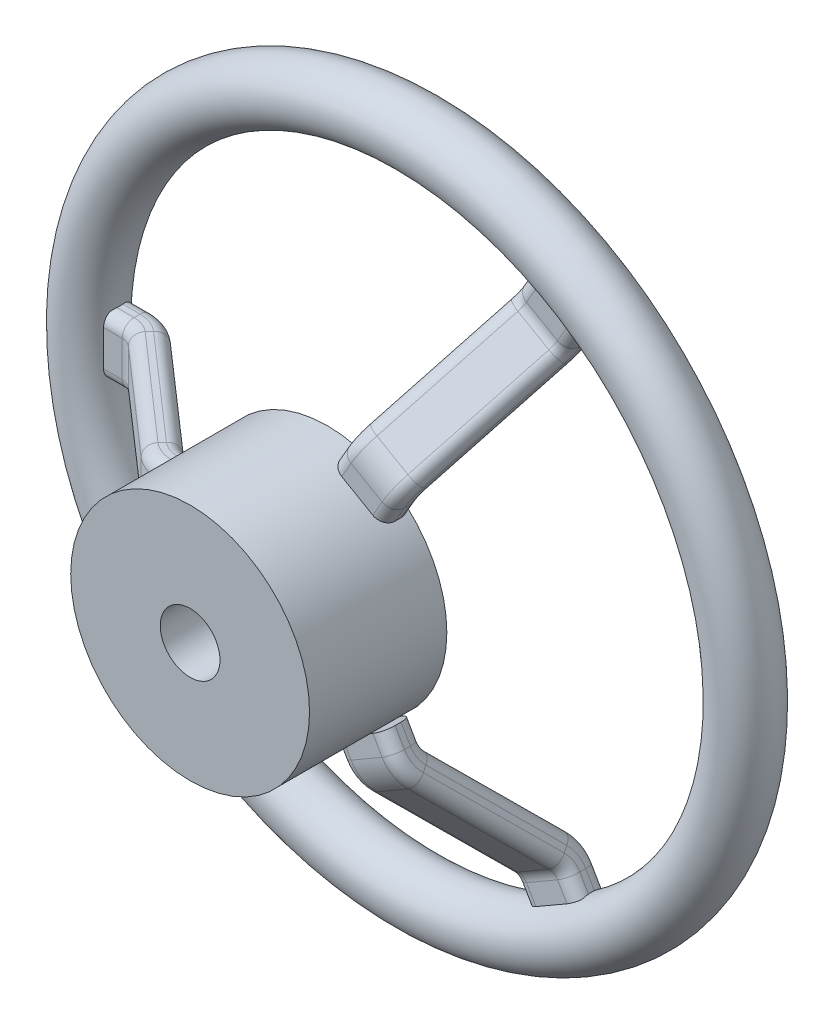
SolidWorks part; units mm, degrees
ref_plane "前视基准面" through (0, 0, 0) normal (0, 0, 1) x (1, 0, 0)
ref_plane "上视基准面" through (0, 0, 0) normal (0, 1, 0) x (1, 0, 0)
ref_plane "右视基准面" through (0, 0, 0) normal (1, 0, 0) x (0, 0, -1)
sketch "草图1" plane through (0, 0, 0) normal (0, 0, 1) x (1, 0, 0)
  circle A0 centre (0, 0) radius 20
  circle A1 centre (0, 0) radius 5
extrude "凸台-拉伸1" add sketch "草图1" along normal blind 23
sketch "草图2" plane through (0, 0, 0) normal (1, 0, 0) x (0, 0, -1)
  line L0 (0, 0) -> (15, 0) construction
  line L1 (15, 0) -> (15, 55) construction
ref_plane "基准面2" through (0, 0, -15) normal (0, 0, -1) x (-1, 0, 0)
sketch "草图4" plane through (0, 0, -15) normal (0, 0, -1) x (-1, 0, 0)
  circle A0 centre (0, 0) radius 55
sketch "草图5" plane through (0, 0, 0) normal (1, 0, 0) x (0, 0, -1)
  circle A0 centre (15, 55) radius 5
sweep "扫描1" add profiles "草图5" path "草图4"
sketch "草图8" plane through (0, 0, 0) normal (0, 1, 0) x (1, 0, 0)
  line L0 (-46.8787, 15) -> (-50, 15)
  line L1 (-23.1213, -2.5) -> (-20, -2.5)
  line L2 (-43.5862, 13.7629) -> (-26.4138, -1.2629)
  arc A0 (-43.5862, 13.7629) -> (-46.8787, 15) centre (-46.8787, 10) ccw
  arc A1 (-23.1213, -2.5) -> (-26.4138, -1.2629) centre (-23.1213, 2.5) cw
  dimension "D1" = 5
ref_plane "基准面4" through (-20, 0, 0) normal (1, 0, 0) x (0, 0, -1)
sketch "草图10" plane through (-20, 0, 0) normal (1, 0, 0) x (0, 0, -1)
  line L1 (-2, 5) -> (-3, 5)
  line L2 (0, 3) -> (0, -3)
  line L3 (-2, -5) -> (-3, -5)
  line L4 (-5, 3) -> (-5, -3)
  line L5 (0, 5) -> (-5, -5) construction
  line L6 (0, -5) -> (-5, 5) construction
  arc A0 (0, -3) -> (-2, -5) centre (-2, -3) cw
  arc A1 (0, 3) -> (-2, 5) centre (-2, 3) ccw
  arc A2 (-3, 5) -> (-5, 3) centre (-3, 3) ccw
  arc A3 (-5, -3) -> (-3, -5) centre (-3, -3) ccw
  point P0 (-2.5, 0)
  dimension "D3" = 2
  dimension "D1" = 10
  dimension "D2" = 5
sweep "扫描7" add profiles "草图10" path "草图8"
sketch "草图11" plane through (-20, 0, 0) normal (1, 0, 0) x (0, 0, -1)
  line L4 (0, -3) -> (0, 3)
  line L5 (-2, 5) -> (-3, 5)
  line L6 (-5, 3) -> (-5, -3)
  line L7 (-3, -5) -> (-2, -5)
  line L8 (0, -3) -> (0, 3)
  line L9 (-2, 5) -> (-3, 5)
  line L10 (-5, 3) -> (-5, -3)
  line L11 (-3, -5) -> (-2, -5)
  arc A4 (-2, -5) -> (0, -3) centre (-2, -3) ccw
  arc A5 (0, 3) -> (-2, 5) centre (-2, 3) ccw
  arc A6 (-3, 5) -> (-5, 3) centre (-3, 3) ccw
  arc A7 (-5, -3) -> (-3, -5) centre (-3, -3) ccw
  arc A8 (-2, -5) -> (0, -3) centre (-2, -3) ccw
  arc A9 (0, 3) -> (-2, 5) centre (-2, 3) ccw
  arc A10 (-3, 5) -> (-5, 3) centre (-3, 3) ccw
  arc A11 (-5, -3) -> (-3, -5) centre (-3, -3) ccw
  dimension "D1" = 0
extrude "凸台-拉伸4" add sketch "草图11" along normal up to surface separate body
pattern_circular "阵列(圆周)8" count 3 over 360 about axis through (0, 0, 0) along (0, 0, 1)
